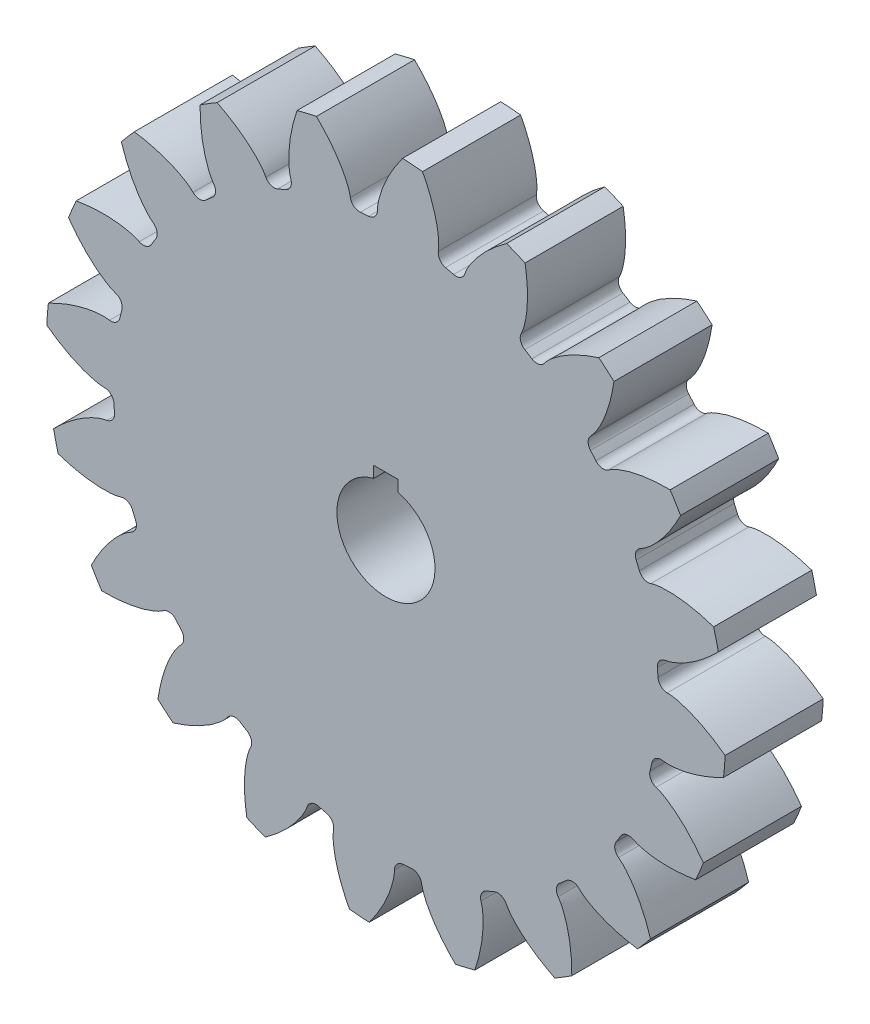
SolidWorks part; units mm, degrees
ref_plane "Front" through (0, 0, 0) normal (0, 0, 1) x (1, 0, 0)
ref_plane "Top" through (0, 0, 0) normal (0, 1, 0) x (1, 0, 0)
ref_plane "Right" through (0, 0, 0) normal (1, 0, 0) x (0, 0, -1)
sketch "Sketch3" plane through (0, 0, 0) normal (0, 0, 1) x (1, 0, 0)
  line L0 (-5.0679, 22.86) -> (0, 0)
  line L1 (0, 0) -> (5.0679, 22.86)
  line L2 (5.0679, 22.86) -> (-5.0679, 22.86) construction
  line L3 (-127, 22.86) -> (127, 22.86)
  line L4 (-254, 0) -> (254, 0)
  line L5 (0, 0) -> (0, 22.86) construction
  dimension "pressure angle" = 25
  dimension "teeth" = 508
  dimension "diametral pitch" = 254
  dimension "% of profile shift" = 22.86
sketch "Sketch1" plane through (0, 0, 0) normal (0, 0, 1) x (1, 0, 0)
  line L0 (-0.6899, 23.0099) -> (0, 0) construction
  line L1 (0, 0) -> (2.3819, 22.8967) construction
  line L2 (2.3819, 22.8967) -> (-0.6778, 23.215) construction
  line L3 (-0.5688, 23.8214) -> (5.4114, 22.3752) construction
  line L4 (5.4114, 22.3752) -> (0, 0) construction
  line L5 (0, 0) -> (8.3443, 21.4547) construction
  line L6 (8.3443, 21.4547) -> (-0.2569, 24.7999) construction
  line L7 (0.3567, 26.1001) -> (11.1284, 20.1516) construction
  line L8 (11.1284, 20.1516) -> (0, 0) construction
  line L9 (1.3602, 27.6526) -> (13.7141, 18.4893) construction
  line L10 (13.7141, 18.4893) -> (0, 0) construction
  line L11 (-25.4, 0) -> (-27.686, 0) construction
  line L12 (9.7288, 20.8634) -> (0, 0) construction
  line L13 (3.9739, 25.0872) -> (0, 25.4) construction
  line L14 (0, 25.4) -> (9.7288, 20.8634) construction
  line L15 (0, 25.4) -> (0, 0) construction
  line L16 (0, 25.4) -> (1.0453, 25.4) construction
  line L17 (3.9739, 25.0872) -> (0, 0) construction
  line L18 (-0.6899, 23.0099) -> (-0.6661, 22.215) construction
  line L22 (0.8047, 26.8499) -> (12.449, 19.3637) construction
  line L23 (2.1725, 27.6006) -> (0, 0) construction
  line L24 (0, 0) -> (12.449, 19.3637) construction
  circle A0 centre (0, 0) radius 25.4 construction
  circle A1 centre (0, 0) radius 22.225 construction
  circle A2 centre (0, 0) radius 23.0202 construction
  circle A5 centre (0, 0) radius 27.686 construction
  arc A7 (1.3602, 27.6526) -> (2.9829, 27.5248) centre (0, 0) cw
  arc A8 (4.1335, 21.8372) -> (-0.6661, 22.215) centre (0, 0) ccw
  spline S0 degree 3 poles (-0.6661, 22.215) (-0.6822, 22.48) (-0.7024, 22.8134) (-0.6727, 23.3521) (-0.5499, 23.9586) (-0.2327, 24.9374) (0.2522, 25.9431) (0.8126, 26.8857) (1.1711, 27.3876) (1.3602, 27.6526) knots 0 0 0 0 0.134075 0.168713 0.272605 0.445753 0.688161 0.835418 1 1 1 1
  spline S1 degree 3 poles (4.1335, 21.8372) (4.1909, 22.0964) (4.263, 22.4225) (4.318, 22.9592) (4.2916, 23.5775) (4.1314, 24.5939) (3.8099, 25.6631) (3.4037, 26.6817) (3.1283, 27.2336) (2.9829, 27.5248) knots 0 0 0 0 0.134075 0.168713 0.272605 0.445753 0.688161 0.835418 1 1 1 1
  point P12 (1.987, 25.2436)
  point P45 (3.9739, 25.0872)
  point P50 (11.1787, 25.3288)
  dimension "D1" = 23.0202
  dimension "Pitch diameter" = 50.8
  dimension "Involute Angle 1" = 7.657
  dimension "Involute Angle 2" = 15.313
  dimension "Involute Angle 3" = 22.97
  dimension "Involute Angle 4" = 30.626
  dimension "Involute Angle 6" = 38.283
  dimension "Involute Length 1" = 3.0763
  dimension "Involute Length 6" = 15.3813
  dimension "Involute Length 2" = 6.1525
  dimension "Involute Length 3" = 9.2288
  dimension "Involute Length 4" = 12.305
  dimension "D13" = 2.286
  dimension "D15" = 10.7345
  dimension "D17" = 9.001
  dimension "pressure angle" = 25
  dimension "Dedendum" = 3.175
  dimension "Tooth Thickness Angle" = 9.001
  dimension "Involute Crux Angle" = 26.717
  dimension "Involute Angle 5" = 34.455
  dimension "Involute Length 5" = 13.8432
  dimension "D24" = 1.6277
sketch "Sketch2" plane through (0, 0, 0) normal (0, 0, 1) x (1, 0, 0)
  circle A3 centre (0, 0) radius 22.225 construction
  circle A4 centre (0, 0) radius 22.225
extrude "Extrude1" add sketch "Sketch2" along normal blind 8
extrude "Extrude2" add sketch "Sketch1" along normal up to surface (8 mm away)
fillet "Fillet1" radius 0.762 2 edges at (4.1335, 21.8372, 4) (-0.6661, 22.215, 4)
pattern_circular "CirPattern1" count 20 over 360 about axis through (0, 0, 8) along (0, 0, -1) of "Extrude2", "Fillet1"
scale "Scale1" scale about centroid uniform scaling yes scale factor 0.25
sketch "Sketch4" plane through (0, 0, 5) normal (0, 0, 1) x (1, 0, 0)
  circle A0 centre (0, 0) radius 1
  dimension "D1" = 2
extrude "Extrude3" cut sketch "Sketch4" against normal through all
sketch "Sketch5" plane through (0, 0, 5) normal (0, 0, 1) x (1, 0, 0)
  line L0 (0, 0) -> (0, 1.2) construction
  line L1 (-0.25, 0) -> (-0.25, 1.2)
  line L2 (-0.25, 1.2) -> (0.25, 1.2)
  line L3 (0.25, 0) -> (0.25, 1.2)
  line L4 (-0.25, 0) -> (0.25, 0)
  dimension "D1" = 1.2
  dimension "D2" = 0.5
extrude "Extrude4" cut sketch "Sketch5" against normal through all
equation "\"Pd\"= 16 ' \"diametral pitch\""
equation "\"N\"= 18 ' Number of \"teeth\""
equation "\"a\"=1/\"Pd\" ' Addendum"
equation "\"d\"= \"N\"/\"Pd\" ' \"Pitch diameter\""
equation "\"phi\"= 20*pi/180 "
equation "\"b\"= 1.25 / \"Pd\" ' \"Dedendum\""
equation "\"br\"=\"d\"/2-\"b\" 'Base Circle Radius"
equation "\"working depth\"= 2 / \"Pd\""
equation "\"Whole depth\"= 2.25 / \"Pd\""
equation "\"Circular tooth thickness\"= 1.571 /\"Pd\""
equation "\"Fillet radius\"= .3 / \"Pd\""
equation "\"minimum basic clearance\"= .25 /\"Pd\""
equation "\"minimum width of top land\"= .25 / \"Pd\""
equation "\"Involute Length 1@Sketch1\" = \"Involute Angle 5@Sketch1\"*\"D1@Sketch1\""
equation "\"Involute Length 2@Sketch1\"=\"Involute Angle 2@Sketch1\"*\"D1@Sketch1\""
equation "\"Involute Length 3@Sketch1\"=\"Involute Angle 3@Sketch1\"*\"D1@Sketch1\""
equation "\"Involute Length 4@Sketch1\"=\"Involute Angle 4@Sketch1\"*\"D1@Sketch1\""
equation "\"Involute Length 6@Sketch1\"=\"Involute Angle 6@Sketch1\"*\"D1@Sketch1\""
equation "\"pressure angle@Sketch1\" = \"phi\""
equation "\"Pitch diameter@Sketch1\" = \"d\""
equation "\"Dedendum@Sketch1\" = \"b\""
equation "\"Fillet Radius@Sketch1\"=\"Fillet radius\""
equation "\"measured circular tooth thickness\"= \"D17@Sketch1\"*\"D20@Sketch1\""
equation "\"Tooth Thickness Angle@Sketch1\"=\"Circular tooth thickness\"/(\"d\"/2)"
equation "\"Involute Crux Angle@Sketch1\"=\"D15@Sketch1\"/\"D1@Sketch1\""
equation "\"Involute Length 5@Sketch1\"=\"Involute Angle 5@Sketch1\"*\"D1@Sketch1\""
